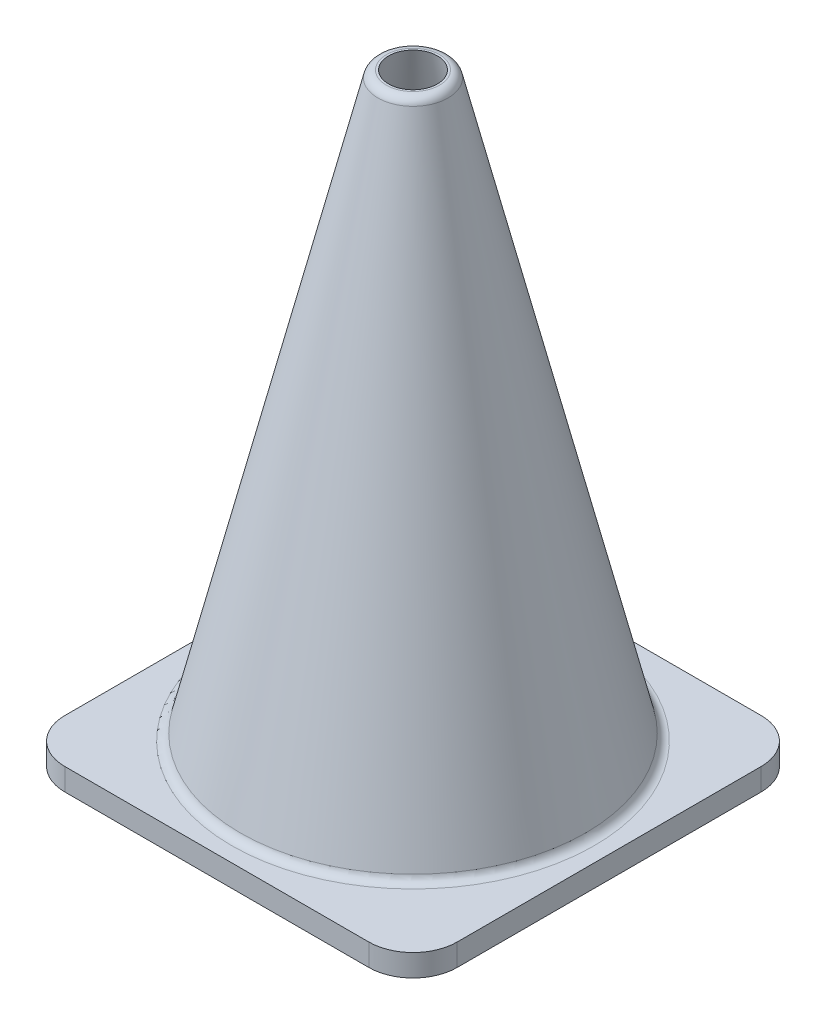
SolidWorks part; units mm, degrees
ref_plane "Front Plane" through (0, 0, 0) normal (0, 0, 1) x (1, 0, 0)
ref_plane "Top Plane" through (0, 0, 0) normal (0, 1, 0) x (1, 0, 0)
ref_plane "Right Plane" through (0, 0, 0) normal (1, 0, 0) x (0, 0, -1)
sketch "Sketch1" plane through (0, 0, 0) normal (0, 0, 1) x (1, 0, 0)
  line L0 (0, 0) -> (0, 50.8) construction
  line L1 (0, 50.8) -> (2.9261, 50.8)
  line L2 (2.9261, 50.8) -> (15.24, 0)
  line L3 (15.24, 0) -> (0, 0)
  line L4 (0, 0) -> (0, 50.8)
  line L5 (0, 110.1454) -> (0, -30.2387) construction
  dimension "D1" = 50.8
  dimension "D2" = 15.24
  dimension "D3" = 2.9261
revolve "Revolve1" add sketch "Sketch1" angle 360 about L5
sketch "Sketch2" plane through (0, 0, 0) normal (0, -1, 0) x (1, 0, 0)
  line L0 (87.0917, 0) -> (-97.1222, 0) construction
  line L1 (17.145, 17.145) -> (-17.145, 17.145)
  line L2 (17.145, 17.145) -> (17.145, -17.145)
  line L3 (17.145, -17.145) -> (-17.145, -17.145)
  line L4 (-17.145, 17.145) -> (-17.145, -17.145)
  line L5 (0, 86.7971) -> (0, -92.8568) construction
  dimension "D1" = 34.29
  dimension "D2" = 34.29
extrude "Extrude1" add sketch "Sketch2" along normal blind 1.9304
fillet "Fillet1" radius 3.8608 4 edges at (-17.145, -0.9652, 17.145) (17.145, -0.9652, 17.145) (17.145, -0.9652, -17.145) (-17.145, -0.9652, -17.145)
fillet "Fillet2" radius 0.7722 2 edges at (0, 50.8, 2.9261) (0, 0, 15.24)
shell "Shell1" thickness 0.7722
equation "\"D2@Sketch1\" = \"D1@Sketch1\" *.3"
equation "\"D2@Sketch2\" = \"D2@Sketch1\"*2.25"
equation "\"D1@Sketch2\" = \"D2@Sketch2\""
equation "\"D1@Extrude1\" = \"D1@Sketch1\"*.038"
equation "\"D1@Fillet1\"=\"D1@Extrude1\"*2"
equation "\"D1@Fillet2\"=\"D1@Fillet1\"*.2"
equation "\"D1@Shell1\" = \"D1@Fillet2\""
equation "\"D3@Sketch1\" = \"D1@Sketch1\"*.0576"
